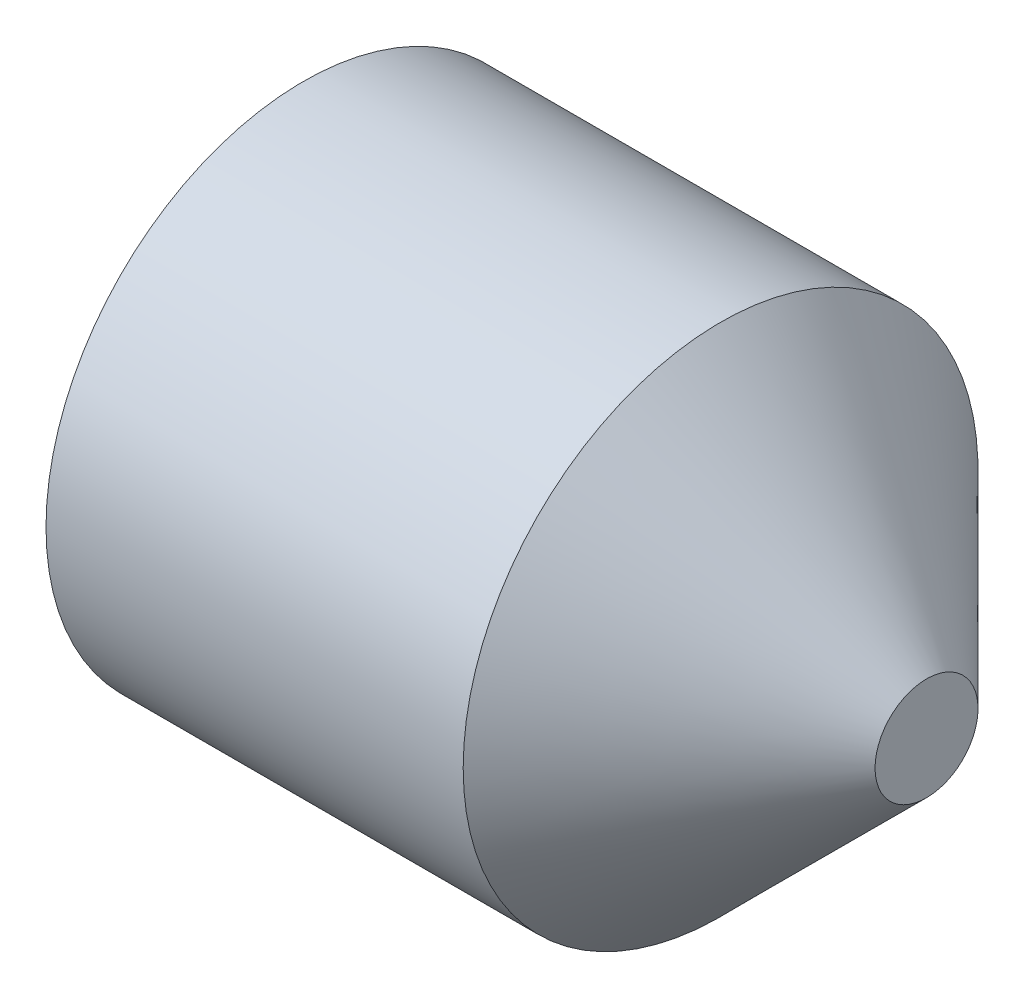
SolidWorks part; units mm, degrees
ref_plane "Plane1" through (0, 0, 0) normal (0, 0, 1) x (1, 0, 0)
ref_plane "Plane2" through (0, 0, 0) normal (0, 1, 0) x (1, 0, 0)
ref_plane "Plane3" through (0, 0, 0) normal (1, 0, 0) x (0, 0, -1)
sketch "BodySke" plane through (0, 0, 0) normal (0, 0, 1) x (1, 0, 0)
  line L0 (0, 0) -> (0, 10.352)
  line L1 (0, 10.352) -> (0.9515, 12)
  line L2 (0.9515, 12) -> (20.4, 12)
  line L3 (30, 0) -> (30, 2.4)
  line L4 (30, 0) -> (0, 0)
  line L5 (-12.7, 0) -> (88.9, 0) construction
  line L6 (30, 2.4) -> (20.4, 12)
  line L7 (3, 15.875) -> (3, -3.175) construction
  line L8 (0, -10.352) -> (0.9515, -12) construction
  line L9 (30, -2.4) -> (20.4, -12) construction
  dimension "Cone_ang" = 90
  dimension "Length" = 30
  dimension "Diameter" = 24
  dimension "Drive_ch_ang" = 60
  dimension "Minor_dia" = 20.704
  dimension "Advance" = 3
  dimension "Tip_dia" = 4.8
revolve "BaseBody" add sketch "BodySke" angle 360 about L5
sketch "Sketch2" plane through (0, 0, 0) normal (-1, 0, 0) x (0, 0, 1)
  line L0 (3.4641, 6) -> (-3.4641, 6)
  line L1 (-3.4641, 6) -> (-6.9282, 0)
  line L2 (3.4641, 6) -> (6.9282, 0)
  line L3 (3.4641, -6) -> (6.9282, 0)
  line L4 (3.4641, -6) -> (-3.4641, -6)
  line L5 (-3.4641, -6) -> (-6.9282, 0)
  dimension "Hex_size" = 12
  dimension "D2" = 6
  dimension "D3" = 6
extrude "Hex" cut sketch "Sketch2" against normal blind 10
sketch "Sketch4" plane through (0, 4.7709, -0.5249) normal (-1, 0, 0) x (0, 0, 1)
  line L0 (0.5249, -4.7709) -> (10.6976, -4.7709)
  line L1 (0.5249, -4.7709) -> (6.6732, -1.2211) construction
  line L2 (0.5249, -4.7709) -> (5.6112, 4.0389)
  line L3 (8.9666, -2.6687) -> (10.2861, -1.9069)
  line L4 (6.5663, 1.4888) -> (7.8858, 2.2506)
  arc A0 (8.9666, -2.6687) -> (6.5663, 1.4888) centre (0.5249, -4.7709) ccw
  arc A1 (10.6976, -4.7709) -> (10.2861, -1.9069) centre (0.5249, -4.7709) ccw
  arc A2 (5.6112, 4.0389) -> (7.8858, 2.2506) centre (0.5249, -4.7709) cw
  circle A3 centre (0.5249, -4.7709) radius 8.6995 construction
  circle A4 centre (0.5249, -4.7709) radius 10.1727 construction
  dimension "D1" = 30
  dimension "Spline_n_dim" = 17.399
  dimension "Spline_m_dim" = 20.3454
  dimension "Spline_a_dim" = 60
  dimension "D3" = 2.4003
  dimension "Spline_p_dim" = 4.8006
extrude "Spline6" [suppressed] cut sketch "Sketch4" against normal blind 12
pattern_circular "CirPattern1" [suppressed] count 6 every 60 about axis through (-12.7, 0, 0) along (1, 0, 0)
sketch "Sketch5" plane through (0, 1.4735, 6.925) normal (-1, 0, 0) x (0, 0, 1)
  line L0 (-6.925, -1.4735) -> (3.2477, -1.4735)
  line L1 (-6.925, -1.4735) -> (-1.9049, 3.5466) construction
  line L2 (-6.925, -1.4735) -> (-6.925, 8.6992)
  line L3 (0.9237, 2.9807) -> (1.7623, 3.8193)
  line L4 (-2.4708, 6.3752) -> (-1.6322, 7.2139)
  line L5 (-2.4708, 6.3752) -> (0.9237, 2.9807)
  arc A1 (3.2477, -1.4735) -> (1.7623, 3.8193) centre (-6.925, -1.4735) ccw
  arc A2 (-6.925, 8.6992) -> (-1.6322, 7.2139) centre (-6.925, -1.4735) cw
  circle A3 centre (-6.925, -1.4735) radius 8.6995 construction
  circle A4 centre (-6.925, -1.4735) radius 10.1727 construction
  dimension "D1" = 45
  dimension "Spline_n_dim" = 17.399
  dimension "Spline_m_dim" = 20.3454
  dimension "Spline_a_dim" = 90
  dimension "D3" = 2.4003
  dimension "Spline_p_dim" = 4.8006
extrude "Spline4" [suppressed] cut sketch "Sketch5" against normal blind 12
pattern_circular "CirPattern2" [suppressed] count 4 every 90 about axis through (-12.7, 0, 0) along (1, 0, 0)
sketch "ThdSchSke" plane through (0, 0, 0) normal (0, 0, 1) x (1, 0, 0)
  line L0 (0.9515, -10.352) -> (-0.2025, -12)
  line L1 (0.9515, -10.352) -> (2.1054, -12)
  line L2 (2.1054, -12) -> (2.1054, -15)
  line L3 (-3.175, 0) -> (5.1513, 0) construction
  line L4 (0.9515, 12) -> (0.9515, -12) construction
  line L5 (2.1054, -15) -> (-0.2025, -15)
  line L6 (-0.2025, -15) -> (-0.2025, -12)
  dimension "Thread_minor" = 20.704
  dimension "Diameter" = 24
  dimension "SideAngle" = 55
  dimension "VeeAngle" = 70
  dimension "Overcut" = 30
revolve "ThreadSchematic" [suppressed] cut sketch "ThdSchSke" angle 360 about L3
pattern_linear "ThdSchPat" [suppressed]
equation "\"D2@Sketch2\" = \"Hex_size@Sketch2\" / 2"
equation "\"D3@Sketch2\" = \"Hex_size@Sketch2\" / 2"
equation "\"Thread_minor@ThreadCosmetic\" = \"Minor_dia@BodySke\""
equation "\"D1@Sketch4\" = \"Spline_a_dim@Sketch4\" / 2"
equation "\"D3@Sketch4\" = \"Spline_p_dim@Sketch4\" / 2"
equation "\"D2@CirPattern1\" = \"Spline_a_dim@Sketch4\""
equation "\"Num_teeth@CirPattern1\" = 360 / \"D2@CirPattern1\""
equation "\"Spline_a_dim@Sketch5\" = 90"
equation "\"Spline_p_dim@Sketch5\" = \"Spline_p_dim@Sketch4\""
equation "\"Spline_m_dim@Sketch5\" = \"Spline_m_dim@Sketch4\""
equation "\"Spline_n_dim@Sketch5\" = \"Spline_n_dim@Sketch4\""
equation "\"D1@Sketch5\" = \"Spline_a_dim@Sketch5\" / 2"
equation "\"D3@Sketch5\" = \"Spline_p_dim@Sketch5\" / 2"
equation "\"Key_eng@Spline4\" = \"Key_eng@Spline6\""
equation "\"Thread_minor@ThdSchSke\" = \"Thread_minor@ThreadCosmetic\""
equation "\"Diameter@ThdSchSke\" = \"Diameter@BodySke\""
equation "\"Overcut@ThdSchSke\" = \"Diameter@BodySke\" * 1.25"
equation "\"Num_threads@ThdSchPat\" = int( (\"Length@BodySke\" - ( ( ( \"Diameter@BodySke\" - \"Minor_dia@BodySke\" ) * 0.5 ) / tan( \"Drive_ch_ang@BodySke\" * 0.017453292 ) ) - ( ( \"Diameter@BodySke\" * 0.5 ) / tan( \"Con"
equation "\"Num_threads@ThdSchPat\" = int( (\"Length@BodySke\" - ( ( ( \"Diameter@BodySke\" - \"Minor_dia@BodySke\" ) * 0.5 ) / tan( \"Drive_ch_ang@BodySke\" * 0.017453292 ) ) - ( (( \"Diameter@BodySke\" - \"Tip_dia@BodySke"
equation "\"Advance@ThdSchPat\" = (\"Length@BodySke\" - ( ( ( \"Diameter@BodySke\" - \"Minor_dia@BodySke\" ) * 0.5 ) / tan( \"Drive_ch_ang@BodySke\" * 0.017453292 ) ) - ( ( \"Diameter@BodySke\" * 0.5 ) / tan( \"Cone_ang@Bod"
equation "\"Advance@ThdSchPat\" = (\"Length@BodySke\" - ( ( ( \"Diameter@BodySke\" - \"Minor_dia@BodySke\" ) * 0.5 ) / tan( \"Drive_ch_ang@BodySke\" * 0.017453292 ) ) - ( ( (\"Diameter@BodySke\" - \"Tip_dia@BodySke\") * 0.5 "
equation "' \"Num_threads@ThdSchPat\" = \"Num_threads@ThdSchPat\" - sgn( \"Num_threads@ThdSchPat\" - 1) '---chamfered tips only---"
